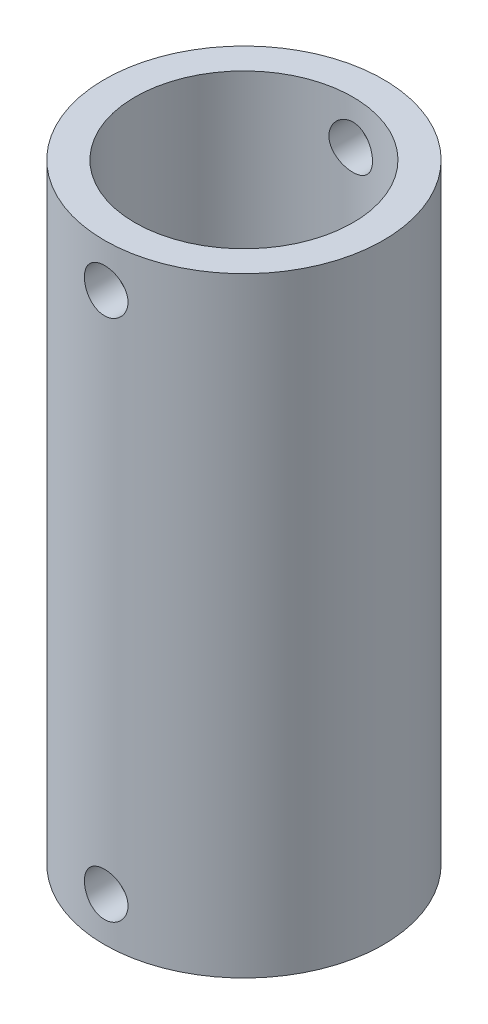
SolidWorks part; units mm, degrees
ref_plane "Front" through (0, 0, 0) normal (0, 0, 1) x (1, 0, 0)
ref_plane "Top" through (0, 0, 0) normal (0, 1, 0) x (1, 0, 0)
ref_plane "Right" through (0, 0, 0) normal (1, 0, 0) x (0, 0, -1)
sketch "Sketch1" plane through (0, 0, 0) normal (0, 1, 0) x (1, 0, 0)
  circle A0 centre (0, 0) radius 12.5
  circle A1 centre (0, 0) radius 16
extrude "Extrude1" add sketch "Sketch1" along normal blind 69.99
sketch "Sketch2" plane through (0, 0, 0) normal (0, 0, 1) x (1, 0, 0)
  circle A0 centre (0, 65) radius 2.5
  circle A1 centre (0, 5) radius 2.5
extrude "Cut-Extrude1" cut sketch "Sketch2" against normal mid plane 40
